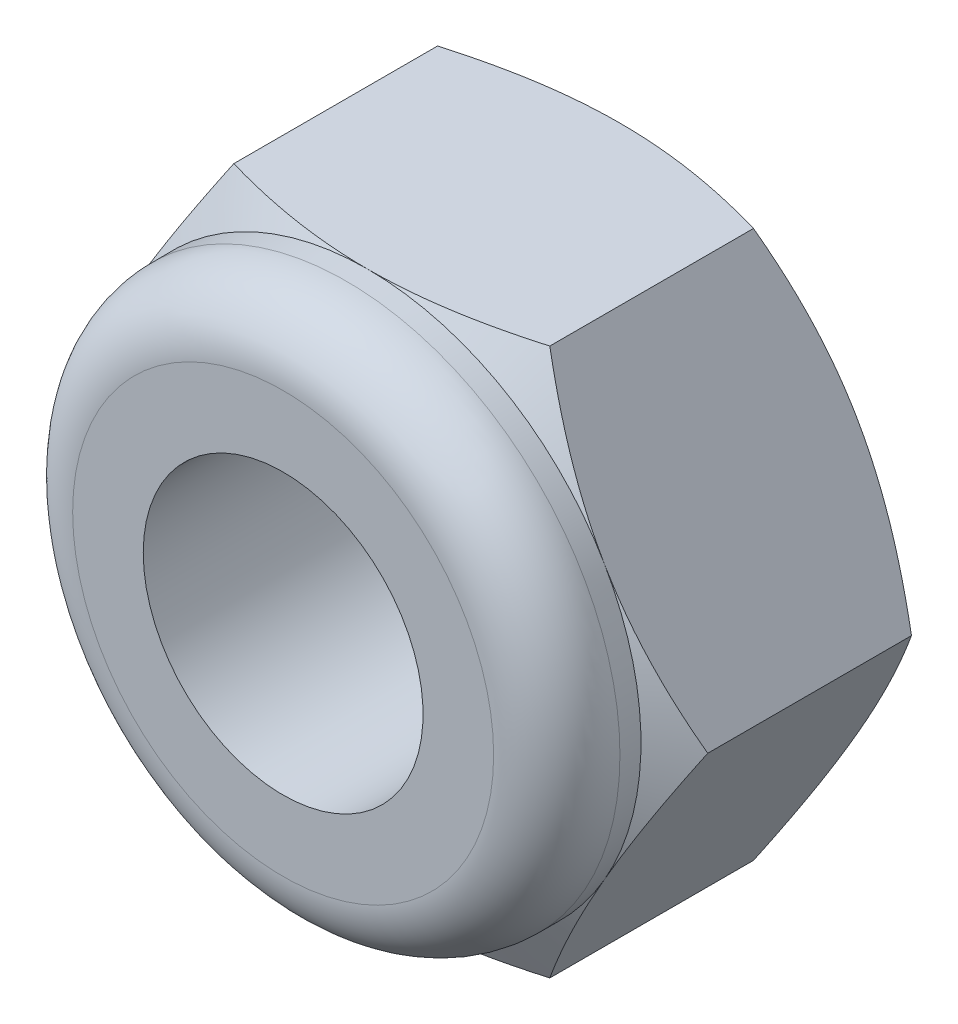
SolidWorks part; units mm, degrees
ref_plane "Plan de face" through (0, 0, 0) normal (0, 0, 1) x (1, 0, 0)
ref_plane "Plan de dessus" through (0, 0, 0) normal (0, 1, 0) x (1, 0, 0)
ref_plane "Plan de droite" through (0, 0, 0) normal (1, 0, 0) x (0, 0, -1)
imported_body "Importée3"
sketch "Esquisse1" plane through (0, 0, 0) normal (0, 0, 1) x (1, 0, 0)
  circle A0 centre (0, 0) radius 6.5
extrude "Boss.-Extru.1" add sketch "Esquisse1" along normal blind 2
hole_wizard "Dégagement M61" positions "Esquisse3" profile "Esquisse2" hole size "M6" standard "Ansi Metric"
sketch "Esquisse3" plane through (0, 0, -6) normal (0, 0, -1) x (-1, 0, 0)
  point P0 (0, 0)
sketch "Esquisse2" plane through (0, 0, -6) normal (1, 0, 0) x (0, 1, 0)
  line L0 (0, 0) -> (0, 8)
  line L1 (0, 8) -> (3.3234, 8)
  line L2 (3.3234, 8) -> (3.3234, 0)
  line L5 (3.3234, 0) -> (0, 0)
  line L11 (0, -6.35) -> (0, 107.95) construction
  dimension "Diamètre du perçage jusqu'au prochain" = 6.6469
  dimension "Profondeur du perçage jusqu'au prochain" = 8
fillet "Congé1" radius 1.5 1 edges at (6.5, 0, 2)
